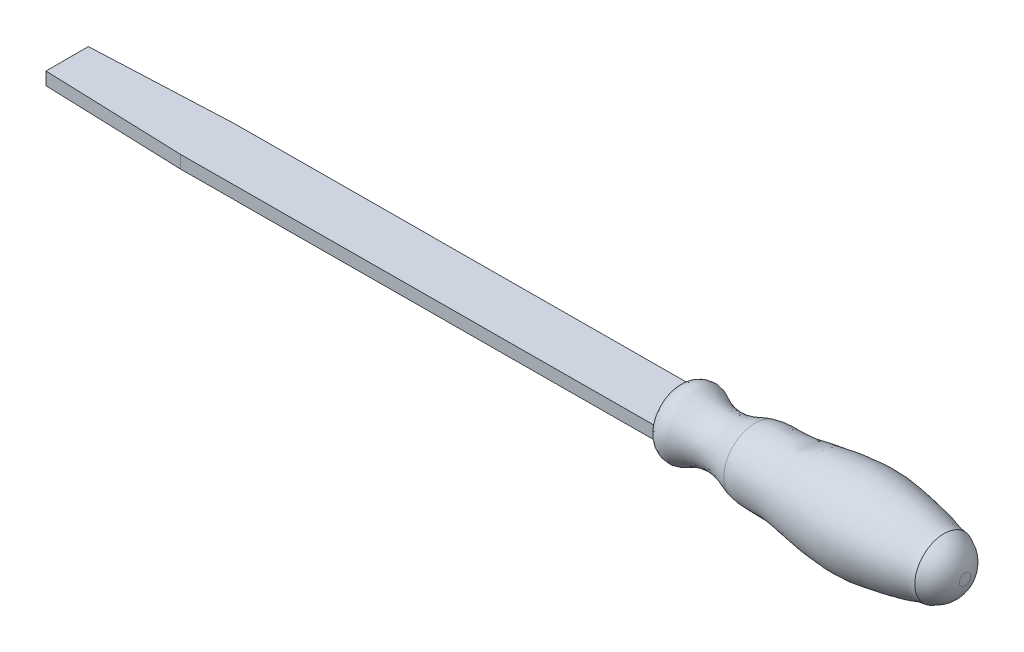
SolidWorks part; units mm, degrees
ref_plane "Front" through (0, 0, 0) normal (0, 0, 1) x (1, 0, 0)
ref_plane "Top" through (0, 0, 0) normal (0, 1, 0) x (1, 0, 0)
ref_plane "Right" through (0, 0, 0) normal (1, 0, 0) x (0, 0, -1)
sketch "Esquisse1" plane through (0, 0, 0) normal (0, 0, 1) x (1, 0, 0)
  line L0 (-5.4706, 0.3329) -> (111.2269, -11.1094) construction
  line L1 (0, 0) -> (0, -3.4014)
  line L2 (0, 0) -> (203.8198, 0.9847) construction
  line L4 (0, 0) -> (112, 0.5411)
  spline S0 degree 2 poles (0, -3.4014) (-0.1556, -7.1644) (0.5454, -10.8775) knots 0 0 0 1 1 1
  spline S1 degree 3 poles (0.5454, -10.8775) (1.3703, -11.9744) (3.3226, -12.8302) (6.1946, -12.9244) (8.2173, -11.8859) (10.5137, -10.6745) (13.2815, -9.8087) (16.632, -9.2235) (20.2629, -9.326) (24.1568, -10.1634) (27.1906, -11.5587) (29.1633, -12.0599) (29.7779, -12.2061) knots 0 0 0 0 0.120356 0.182103 0.252494 0.320379 0.416926 0.51167 0.625759 0.741662 0.867963 0.924774 0.924774 0.924774 0.924774
  spline S2 degree 3 poles (29.7779, -12.2061) (31.1346, -12.4504) (33.1676, -12.8911) (36.3876, -12.9051) (39.1715, -12.8799) (42.6259, -12.9791) (46.218, -13.347) (49.9167, -14.0068) (53.6218, -14.6405) (57.2662, -15.1744) (61.1202, -15.6812) (65.1405, -15.9976) (69.272, -16.4214) (73.6066, -16.3521) (77.7839, -16.2162) (81.9902, -15.5316) (86.3141, -14.804) (91.8474, -13.8515) (97.7509, -12.539) (101.9294, -10.9604) (103.8184, -10.9882) knots 0 0 0 0 0.055398 0.082677 0.128818 0.167035 0.221097 0.273334 0.317568 0.371734 0.420941 0.473294 0.533363 0.587168 0.646878 0.700632 0.757711 0.822668 0.925589 1 1 1 1
  spline S3 degree 3 poles (103.8184, -10.9882) (105.3866, -10.3956) (109.2102, -8.227) (111.463, -4.2308) (111.9223, -1.6522) knots 0 0 0 0 0.390825 1 1 1 1
  spline S8 degree 2 poles (112, 0.5411) (112.0053, -0.5553) (111.9223, -1.6522) knots 0.5 0.5 0.5 1 1 1
  point P4 (69.7283, -16.1677)
  point P17 (73.8825, -16.1677)
  point P30 (77.9798, -15.8262)
  point P34 (64.9481, -15.9969)
  point P36 (73.9963, -16.4522)
  point P38 (77.9229, -16.1107)
  point P40 (81.9064, -15.5417)
  point P42 (69.5576, -16.3953)
  point P44 (73.8758, -16.4365)
  point P46 (69.4314, -16.3439)
  point P48 (73.4592, -16.3439)
  dimension "D1" = 112
revolve "Révolution2" add sketch "Esquisse1" angle 360 about L4
ref_plane "Plan1" through (-0.0164, -0.0001, 0) normal (1, 0.0048, 0) x (0, 0, -1)
sketch "Esquisse4" plane through (-0.0164, -0.0001, 0) normal (1, 0.0048, 0) x (0, 0, -1)
  line L1 (-10.5, -2.5) -> (10.5, -2.5)
  line L2 (-10.5, -2.5) -> (-10.5, 2.5)
  line L3 (-10.5, 2.5) -> (10.5, 2.5)
  line L4 (10.5, -2.5) -> (10.5, 2.5)
  line L5 (-10.5, -2.5) -> (10.5, 2.5) construction
  line L6 (-10.5, 2.5) -> (10.5, -2.5) construction
  point P0 (0, 0)
  dimension "D1" = 5
  dimension "D2" = 21
extrude "Boss.-Extru.2" add sketch "Esquisse4" against normal blind 240 and the other way up to next
sketch "Esquisse5" plane through (-0.0121, 2.5, 0) normal (-0.0048, 1, 0) x (1, 0.0048, 0)
  line L0 (-240.0164, 8.3) -> (-185.0164, 10.5)
  line L1 (-240.0164, 10.5) -> (-240.0164, -10.5) construction
  line L2 (-240.0164, 10.5) -> (0.477, 10.5) construction
  line L3 (-185.0164, 10.5) -> (-240.0164, 10.5)
  line L4 (-240.0164, 10.5) -> (-240.0164, 8.3)
  dimension "D1" = 55
  dimension "D2" = 2.2
extrude "Enlèv. mat.-Extru.1" cut sketch "Esquisse5" against normal through all
mirror "Symétrie1" about plane through (0, 0, 0) normal (0, 0, 1) of "Enlèv. mat.-Extru.1"
